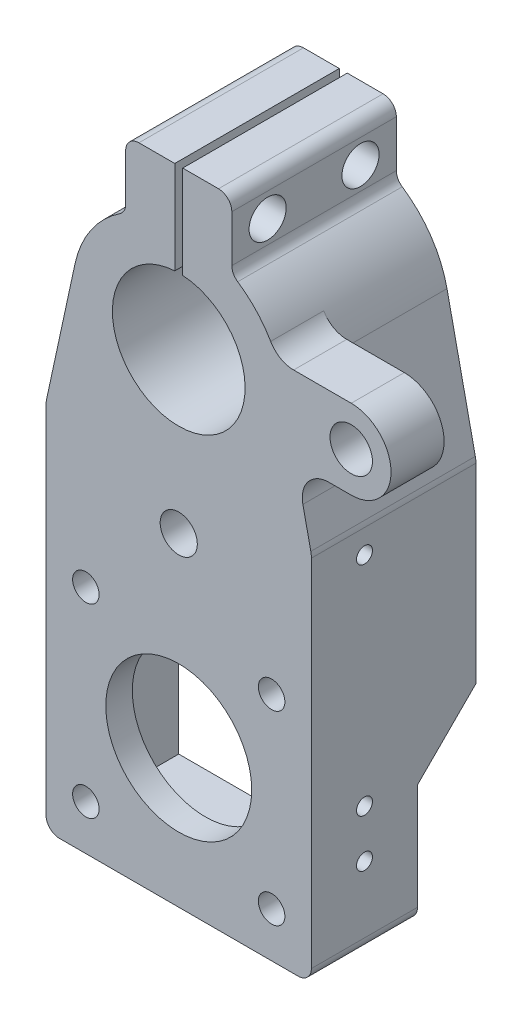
SolidWorks part; units mm, degrees
ref_plane "前视基准面" through (0, 0, 0) normal (0, 0, 1) x (1, 0, 0)
ref_plane "上视基准面" through (0, 0, 0) normal (0, 1, 0) x (1, 0, 0)
ref_plane "右视基准面" through (0, 0, 0) normal (1, 0, 0) x (0, 0, -1)
sketch "草图1" plane through (0, 0, 0) normal (0, 0, 1) x (1, 0, 0)
  line L0 (0, 0) -> (50, 0) construction
  line L1 (0, 0) -> (0, 130) construction
  line L2 (50, 86.9318) -> (50, -47)
  line L3 (45, -52) -> (-45, -52)
  line L4 (-50, -47) -> (-50, 86.9318)
  line L5 (0, 130) -> (0, 190) construction
  line L6 (0, 190) -> (15, 190)
  line L7 (0, 190) -> (-15, 190)
  line L8 (-20, 185) -> (-20, 167.4166)
  line L9 (20, 185) -> (20, 167.4166)
  line L10 (0, 130) -> (65, 130) construction
  line L11 (-49.7744, 89.0441) -> (-39.0974, 138.4493)
  line L12 (49.7744, 89.0441) -> (46.7826, 102.8877)
  line L13 (65, 115) -> (56.557, 115)
  line L14 (65, 145) -> (43.3013, 145)
  line L15 (0, 0) -> (-35, 0) construction
  line L16 (-35, 0) -> (-35, -35) construction
  circle A0 centre (0, 130) radius 25
  circle A1 centre (0, 0) radius 27.5
  arc A2 (34.641, 150) -> (22.2222, 163.2592) centre (0, 130) ccw
  arc A3 (65, 115) -> (65, 145) centre (65, 130) ccw
  circle A4 centre (65, 130) radius 8
  arc A5 (-22.2222, 163.2592) -> (-39.0974, 138.4493) centre (0, 130) ccw
  arc A6 (20, 167.4166) -> (22.2222, 163.2592) centre (25, 167.4166) ccw
  arc A7 (-20, 167.4166) -> (-22.2222, 163.2592) centre (-25, 167.4166) cw
  arc A8 (50, -47) -> (45, -52) centre (45, -47) cw
  arc A9 (-50, -47) -> (-45, -52) centre (-45, -47) ccw
  arc A10 (15, 190) -> (20, 185) centre (15, 185) cw
  arc A11 (-20, 185) -> (-15, 190) centre (-15, 185) cw
  arc A12 (-49.7744, 89.0441) -> (-50, 86.9318) centre (-40, 86.9318) ccw
  arc A13 (49.7744, 89.0441) -> (50, 86.9318) centre (40, 86.9318) cw
  arc A14 (56.557, 115) -> (46.7826, 102.8877) centre (56.557, 105) ccw
  arc A15 (34.641, 150) -> (43.3013, 145) centre (43.3013, 155) ccw
  circle A16 centre (-35, -35) radius 5
  circle A17 centre (-35, 35) radius 5
  circle A18 centre (35, -35) radius 5
  circle A19 centre (35, 35) radius 5
  point P39 (-50, 88)
  point P42 (50, 88)
  dimension "D1" = 5
  dimension "D2" = 10
extrude "凸台-拉伸1" add sketch "草图1" along normal blind 20
sketch "草图2" plane through (0, 0, 0) normal (0, 0, -1) x (-1, 0, 0)
  line L0 (-20, 167.4166) -> (-20, 185) construction
  line L1 (-15, 190) -> (15, 190) construction
  line L2 (20, 185) -> (20, 167.4166) construction
  line L3 (39.0974, 138.4493) -> (49.7744, 89.0441) construction
  line L4 (50, 86.9318) -> (50, -47) construction
  line L5 (45, -52) -> (-45, -52) construction
  line L6 (-20, 167.4166) -> (-20, 185)
  line L7 (-15, 190) -> (15, 190)
  line L8 (20, 185) -> (20, 167.4166)
  line L9 (39.0974, 138.4493) -> (49.7744, 89.0441)
  line L10 (50, 86.9318) -> (50, -47)
  line L11 (45, -52) -> (-45, -52)
  line L12 (0, 0) -> (0, 70) construction
  line L13 (-39.0974, 138.4493) -> (-49.7744, 89.0441)
  line L14 (-50, 86.9318) -> (-50, -47)
  arc A0 (-15, 190) -> (-20, 185) centre (-15, 185) ccw construction
  arc A1 (20, 185) -> (15, 190) centre (15, 185) ccw construction
  arc A2 (20, 167.4166) -> (22.2222, 163.2592) centre (25, 167.4166) ccw construction
  arc A3 (39.0974, 138.4493) -> (22.2222, 163.2592) centre (0, 130) ccw construction
  arc A4 (50, 86.9318) -> (49.7744, 89.0441) centre (40, 86.9318) ccw construction
  circle A5 centre (0, 130) radius 25 construction
  circle A6 centre (-35, 35) radius 5 construction
  circle A7 centre (35, 35) radius 5 construction
  arc A8 (45, -52) -> (50, -47) centre (45, -47) ccw construction
  circle A9 centre (35, -35) radius 5 construction
  circle A10 centre (0, 0) radius 27.5 construction
  circle A11 centre (-35, -35) radius 5 construction
  arc A12 (-50, -47) -> (-45, -52) centre (-45, -47) ccw construction
  arc A13 (-15, 190) -> (-20, 185) centre (-15, 185) ccw
  arc A14 (20, 185) -> (15, 190) centre (15, 185) ccw
  arc A15 (20, 167.4166) -> (22.2222, 163.2592) centre (25, 167.4166) ccw
  arc A16 (39.0974, 138.4493) -> (22.2222, 163.2592) centre (0, 130) ccw
  arc A17 (50, 86.9318) -> (49.7744, 89.0441) centre (40, 86.9318) ccw
  circle A18 centre (0, 130) radius 25
  circle A19 centre (-35, 35) radius 5
  circle A20 centre (35, 35) radius 5
  arc A21 (45, -52) -> (50, -47) centre (45, -47) ccw
  circle A22 centre (35, -35) radius 5
  circle A23 centre (0, 0) radius 27.5
  circle A24 centre (-35, -35) radius 5
  arc A25 (-50, -47) -> (-45, -52) centre (-45, -47) ccw
  circle A26 centre (0, 70) radius 7
  arc A27 (-39.0974, 138.4493) -> (-22.2222, 163.2592) centre (0, 130) cw
  arc A28 (-50, 86.9318) -> (-49.7744, 89.0441) centre (-40, 86.9318) cw
  arc A29 (-22.2222, 163.2592) -> (-20, 167.4166) centre (-25, 167.4166) ccw construction
  arc A30 (-22.2222, 163.2592) -> (-20, 167.4166) centre (-25, 167.4166) ccw
extrude "凸台-拉伸2" add sketch "草图2" along normal blind 42
sketch "草图3" plane through (0, 0, -42) normal (0, 0, -1) x (-1, 0, 0)
  circle A0 centre (0, 70) radius 7 construction
  circle A1 centre (0, 70) radius 7
extrude "切除-拉伸1" cut sketch "草图3" against normal through all
sketch "草图4" plane through (0, 0, -42) normal (0, 0, -1) x (-1, 0, 0)
  line L0 (0, 0) -> (40, 0) construction
  line L1 (40, 81.0102) -> (40, -42)
  line L2 (40, -42) -> (-40, -42)
  line L3 (-40, -42) -> (-40, 81.0102)
  arc A0 (-18.1818, 94.3711) -> (18.1818, 94.3711) centre (0, 130) ccw
  arc A1 (-40, 81.0102) -> (-18.1818, 94.3711) centre (-25, 81.0102) cw
  arc A2 (18.1818, 94.3711) -> (40, 81.0102) centre (25, 81.0102) cw
  dimension "D1" = 15
  dimension "D2" = 15
extrude "切除-拉伸2" cut sketch "草图4" against normal blind 52
sketch "草图5" plane through (0, 190, 0) normal (0, 1, 0) x (1, 0, 0)
  line L1 (1.5, 49.1065) -> (-1.5, 49.1065)
  line L2 (1.5, 49.1065) -> (1.5, -49.1065)
  line L3 (1.5, -49.1065) -> (-1.5, -49.1065)
  line L4 (-1.5, 49.1065) -> (-1.5, -49.1065)
  line L5 (1.5, 49.1065) -> (-1.5, -49.1065) construction
  line L6 (1.5, -49.1065) -> (-1.5, 49.1065) construction
  point P0 (0, 0)
  dimension "D1" = 3
extrude "切除-拉伸3" cut sketch "草图5" against normal blind 41
sketch "草图6" plane through (20, 0, 0) normal (1, 0, 0) x (0, 0, -1)
  line L0 (42, 185) -> (42, 167.4166) construction
  line L1 (-20, 167.4166) -> (-20, 185) construction
  line L2 (-20, 190) -> (42, 190) construction
  circle A0 centre (-6.5, 176) radius 7
  circle A1 centre (28.5, 176) radius 7
  dimension "D1" = 13.5
  dimension "D2" = 13.5
  dimension "D3" = 14
  dimension "D4" = 14
extrude "切除-拉伸4" cut sketch "草图6" against normal blind 10
sketch "草图7" plane through (10, 0, 0) normal (1, 0, 0) x (0, 0, -1)
  circle A0 centre (-6.5, 176) radius 4.5
  circle A1 centre (28.5, 176) radius 4.5
extrude "切除-拉伸5" cut sketch "草图7" against normal up to surface (30 mm away)
sketch "草图8" plane through (50, 0, 0) normal (1, 0, 0) x (0, 0, -1)
  line L0 (-20, -52) -> (42, -52) construction
  line L1 (20, -52) -> (42, -52)
  line L2 (42, -52) -> (42, -7) construction
  line L3 (42, -7) -> (20, -7) construction
  line L4 (20, -7) -> (42, 15)
  line L5 (20, -7) -> (20, -52)
  line L6 (42, 86.9318) -> (42, -47) construction
  line L7 (42, 15) -> (42, -52)
extrude "切除-拉伸7" cut sketch "草图8" against normal blind 100
sketch "草图9" plane through (50, 0, 0) normal (1, 0, 0) x (0, 0, -1)
  line L0 (-20, -52) -> (20, -52) construction
  line L1 (-20, -47) -> (-20, 86.9318) construction
  circle A0 centre (0, -22) radius 3
  circle A1 centre (0, -4) radius 3
  circle A2 centre (0, 78) radius 3
  dimension "D1" = 30
  dimension "D2" = 18
  dimension "D3" = 82
  dimension "D4" = 20
  dimension "D5" = 20
  dimension "D6" = 20
extrude "切除-拉伸8" cut sketch "草图9" against normal blind 10
sketch "草图10" plane through (-65.9381, 14.2498, 0) normal (-0.9774, 0.2112, 0) x (0, 0, 1)
  line L0 (20, 127.0666) -> (-42, 127.0666) construction
  line L2 (20, 127.0666) -> (20, 76.5209) construction
  circle A0 centre (-10, 108.0666) radius 2.5
  circle A1 centre (-10, 96.0666) radius 2.5
  dimension "D1" = 12
  dimension "D2" = 19
  dimension "D3" = 30
extrude "切除-拉伸9" cut sketch "草图10" against normal blind 10
